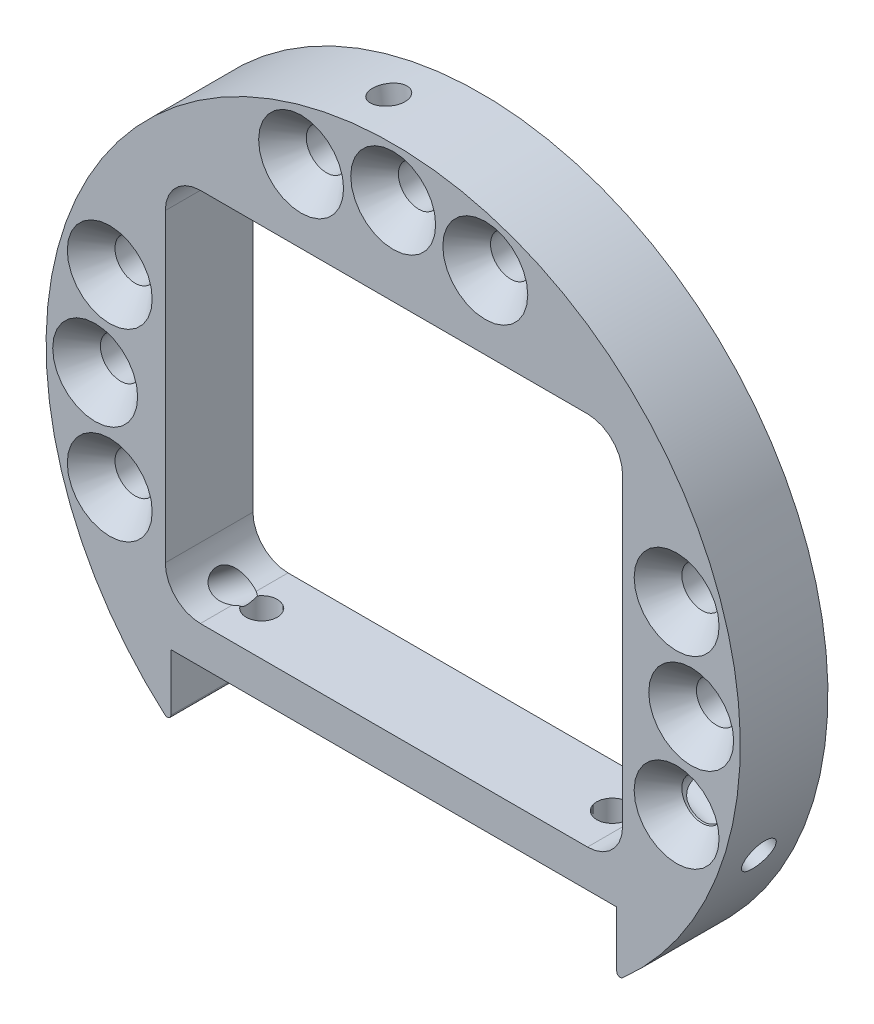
SolidWorks part; units mm, degrees
ref_plane "Front Plane" through (0, 0, 0) normal (0, 0, 1) x (1, 0, 0)
ref_plane "Top Plane" through (0, 0, 0) normal (0, 1, 0) x (1, 0, 0)
ref_plane "Right Plane" through (0, 0, 0) normal (1, 0, 0) x (0, 0, -1)
sketch "Sketch1" plane through (0, 0, 0) normal (0, 0, 1) x (1, 0, 0)
  line L0 (0, 0) -> (-25.146, 0) construction
  line L1 (0, 0) -> (12.573, 21.7771) construction
  line L2 (0, 0) -> (12.573, -21.7771) construction
  circle A0 centre (0, 0) radius 25.146
  dimension "D1" = 50.292
  dimension "D2" = 120
  dimension "D3" = 120
extrude "Boss-Extrude1" add sketch "Sketch1" along normal blind 6.35
sketch "Sketch2" plane through (0, 0, 6.35) normal (0, 0, 1) x (1, 0, 0)
  line L1 (-24.9185, -14.6395) -> (24.0391, -14.6395)
  line L2 (-24.9185, -14.6395) -> (-24.9185, -26.8241)
  line L3 (-24.9185, -26.8241) -> (24.0391, -26.8241)
  line L4 (24.0391, -14.6395) -> (24.0391, -26.8241)
extrude "Cut-Extrude1" cut sketch "Sketch2" against normal blind 4.7625
sketch "Sketch3" plane through (0, 0, 6.35) normal (0, 0, 1) x (1, 0, 0)
  line L1 (29.7951, -26.5733) -> (19.05, -26.5733)
  line L2 (29.7951, -26.5733) -> (29.7951, 23.8125)
  line L3 (29.7951, 23.8125) -> (19.05, 23.8125)
  line L4 (19.05, -26.5733) -> (19.05, 23.8125)
  dimension "D1" = 19.05
extrude "Cut-Extrude3" cut sketch "Sketch3" against normal blind 4.7625
sketch "Sketch5" plane through (0, 0, 6.35) normal (0, 0, 1) x (1, 0, 0)
  line L0 (16.1942, -14.6395) -> (16.1942, -19.2372)
  line L1 (19.05, -14.6395) -> (-20.4452, -14.6395) construction
  line L2 (19.05, -14.6395) -> (20.4452, -14.6395)
  line L3 (16.1942, -14.6395) -> (19.05, -14.6395)
  line L4 (-16.1067, -14.6395) -> (-16.1067, -19.3105)
  line L5 (-20.4452, -14.6395) -> (-16.1067, -14.6395)
  circle A0 centre (0, 0) radius 25.146 construction
  arc A1 (16.1942, -19.2372) -> (20.4452, -14.6395) centre (0, 0) ccw
  arc A2 (-16.1067, -19.3105) -> (-20.4452, -14.6395) centre (0, 0) cw
extrude "Boss-Extrude2" add sketch "Sketch5" against normal blind 4.7625
hole_wizard "#4-40 Tapped Hole1" positions "Sketch6" profile "Sketch7" tap size "#4-40" standard "ANSI Inch"
sketch "Sketch6" plane through (0, -14.6395, 0) normal (0, -1, 0) x (-1, 0, 0)
  line L0 (-16.1942, 0) -> (16.1067, 0) construction
  point P0 (12.7, -3.175)
  point P2 (-12.7, -3.175)
  dimension "D1" = 25.4
  dimension "D2" = 12.7
  dimension "D3" = 3.175
sketch "Sketch7" plane through (-12.7, -14.6395, 3.175) normal (1, 0, 0) x (0, 0, -1)
  line L0 (0, 0) -> (0, 6.7752)
  line L1 (0, 6.7752) -> (1.1303, 6.096)
  line L2 (1.1303, 6.096) -> (1.1303, 0)
  line L5 (1.1303, 0) -> (0, 0)
  line L10 (0, 6.7752) -> (-1.1303, 6.096) construction
  line L11 (0, -6.35) -> (0, 107.95) construction
  dimension "Tap Drill Dia." = 2.2606
  dimension "Tap Drill Depth" = 6.096
  dimension "Drill Angle" = 118
sketch "Sketch8" plane through (0, 0, 6.35) normal (0, 0, 1) x (1, 0, 0)
  line L0 (16.6168, 11.9363) -> (16.6168, 15.4391)
  line L3 (-19.2876, -11.9363) -> (16.6168, -11.9363)
  line L4 (16.6168, 11.9363) -> (16.6168, -11.9363)
  circle A0 centre (0, 0) radius 22.6823 construction
  arc A2 (16.6168, 15.4391) -> (-19.2876, -11.9363) centre (0, 0) ccw
  point P0 (0, 0)
extrude "Cut-Extrude4" cut sketch "Sketch8" against normal blind 6.35
sketch "Sketch9" plane through (0, 0, 6.35) normal (0, 0, 1) x (1, 0, 0)
  line L0 (-14.0723, 17.7892) -> (14.0723, 17.7892)
  circle A0 centre (0, 0) radius 22.6823 construction
  arc A1 (14.0723, 17.7892) -> (-14.0723, 17.7892) centre (0, 0) ccw
extrude "Boss-Extrude3" add sketch "Sketch9" against normal blind 6.35 separate body
combine bodies "Combine1" operation type add bodies to combine 106 107
sketch "Sketch12" plane through (0, 0, 6.35) normal (0, 0, 1) x (1, 0, 0)
  line L0 (19.05, 16.414) -> (19.05, -14.6395) construction
  line L1 (19.05, 16.414) -> (18.1261, 16.414)
  line L2 (18.1261, 16.414) -> (18.1261, -15.0455)
  line L3 (18.1261, -15.0455) -> (20.1483, -15.0455)
  arc A0 (19.05, 16.414) -> (20.1483, -15.0455) centre (0, 0) cw
extrude "Boss-Extrude4" add sketch "Sketch12" against normal up to surface (6.35 mm away)
mirror "Mirror1" about plane through (0, 0, 0) normal (1, 0, 0) of "Boss-Extrude4"
sketch "Sketch13" plane through (0, 0, 6.35) normal (0, 0, 1) x (1, 0, 0)
  line L0 (-16.51, 16.3128) -> (-16.51, -12.6861)
  line L2 (-16.51, -12.6861) -> (-19.239, -12.6541)
  line L3 (-19.239, -12.6541) -> (-19.239, 13.8267)
  line L4 (-19.239, 13.8267) -> (-16.51, 16.3128)
  dimension "D1" = 16.51
extrude "Boss-Extrude7" add sketch "Sketch13" against normal up to surface (6.35 mm away) contours L3 L4 L0 L2
ref_plane "Plane1" through (16.6168, -11.9363, 6.35) normal (1, 0, 0) x (0, 0, -1)
sketch "Sketch14" plane through (0, 0, 6.35) normal (0, 0, 1) x (1, 0, 0)
  line L0 (-17.8389, 15.24) -> (17.6266, 15.24)
  line L1 (17.6266, 15.24) -> (15.248, 17.2787)
  line L2 (15.248, 17.2787) -> (13.7912, 18.6451)
  line L3 (13.7912, 18.6451) -> (-12.9382, 18.6451)
  line L4 (-12.9382, 18.6451) -> (-16.0975, 17.0228)
  line L5 (-16.0975, 17.0228) -> (-17.8389, 15.24)
  dimension "D1" = 15.24
extrude "Boss-Extrude8" add sketch "Sketch14" against normal up to surface (6.35 mm away)
sketch "Sketch16" plane through (0, 0, 6.35) normal (0, 0, 1) x (1, 0, 0)
  line L1 (-16.51, 20.7015) -> (16.51, 20.7015)
  line L2 (-16.51, 20.7015) -> (-16.51, -12.3185)
  line L3 (-16.51, -12.3185) -> (16.51, -12.3185)
  line L4 (16.51, 20.7015) -> (16.51, -12.3185)
  line L5 (-16.51, 20.7015) -> (16.51, -12.3185) construction
  line L6 (-16.51, -12.3185) -> (16.51, 20.7015) construction
  point P0 (0, 4.1915)
  dimension "D1" = 33.02
  dimension "D2" = 33.02
hole_wizard "CSK for #4 Flat Head Machine Screw (100)1" positions "Sketch10" profile "Sketch11" countersink size "#4" standard "ANSI Inch"
sketch "Sketch10" plane through (0, 0, 6.35) normal (0, 0, 1) x (1, 0, 0)
  point P0 (0, 21.59)
  dimension "D1" = 21.59
sketch "Sketch11" plane through (0, 21.59, 6.35) normal (1, 0, 0) x (0, -1, 0)
  line L0 (0, 0) -> (0, 26.2852)
  line L1 (0, 26.2852) -> (1.4732, 25.4)
  line L2 (1.4732, 25.4) -> (1.4732, 1.8465)
  line L3 (1.4732, 1.8465) -> (3.0783, 0)
  line L5 (3.0783, 0) -> (0, 0)
  line L6 (-1.4732, 1.8465) -> (-3.0783, 0) construction
  line L10 (0, 26.2852) -> (-1.4732, 25.4) construction
  line L11 (0, -6.35) -> (0, 107.95) construction
  dimension "Hole Dia." = 2.9464
  dimension "Hole Depth" = 25.4
  dimension "Near C'Sink Dia." = 6.1566
  dimension "Near C'Sink Angle" = 82
  dimension "Drill Angle" = 118
pattern_circular "CirPattern1" count 4 over 360 about axis through (0, 0, 0) along (0, 0, 1) of "CSK for #4 Flat Head Machine Screw (100)1"
pattern_circular "CirPattern2" count 2 every 18 about axis through (0, 0, 0) along (0, 0, 1) of "CirPattern1", "CSK for #4 Flat Head Machine Screw (100)1"
pattern_circular "CirPattern3" count 2 every 18 about axis through (0, 0, 0) along (0, 0, 1) of "CirPattern1", "CSK for #4 Flat Head Machine Screw (100)1"
fillet "Fillet7" radius 2.54 4 edges at (-16.51, -11.9363, 3.175) (16.6168, -11.9363, 3.175) (16.6168, 15.24, 3.175) (-16.51, 15.24, 3.175)
sketch "Sketch18" plane through (0, 0, 1.5875) normal (0, 0, 1) x (1, 0, 0)
  line L1 (-16.1067, -14.6395) -> (16.1942, -14.6395)
  line L2 (-16.1067, -14.6395) -> (-16.1067, -26.8579)
  line L3 (-16.1067, -26.8579) -> (16.1942, -26.8579)
  line L4 (16.1942, -14.6395) -> (16.1942, -26.8579)
extrude "Cut-Extrude5" cut sketch "Sketch18" against normal through all
fillet "Fillet2" radius 0.254 2 edges at (16.1942, -19.2372, 3.175) (-16.1067, -19.3105, 3.175)
ref_plane "Plane3" through (0, 0, 3.175) normal (0, 0, 1) x (1, 0, 0)
sketch "Sketch21" plane through (0, 0, 3.175) normal (0, 0, 1) x (1, 0, 0)
  line L0 (0, 0) -> (-3.9715, 28.2587)
  line L1 (0, 0) -> (0, 30.0835) construction
  dimension "D1" = 8
ref_plane "Plane2" through (-3.9715, 28.2587, 3.175) normal (-0.1392, 0.9903, 0) x (0.9903, 0.1392, 0)
hole_wizard "#4-48 Tapped Hole1" positions "Sketch19" profile "Sketch20" tap size "#4-48" standard "ANSI Inch"
sketch "Sketch19" plane through (-3.9715, 28.2587, 3.175) normal (-0.1392, 0.9903, 0) x (0.9903, 0.1392, 0)
  point P0 (0, 0)
  dimension "D1" = 3.175
sketch "Sketch20" plane through (-3.9715, 28.2587, 3.175) normal (0, 0, 1) x (-0.9903, -0.1392, 0)
  line L0 (0, 0) -> (0, 19.7635)
  line L1 (0, 19.7635) -> (1.1874, 19.05)
  line L2 (1.1874, 19.05) -> (1.1874, 0)
  line L5 (1.1874, 0) -> (0, 0)
  line L10 (0, 19.7635) -> (-1.1875, 19.05) construction
  line L11 (0, -6.35) -> (0, 107.95) construction
  dimension "Tap Drill Dia." = 2.3749
  dimension "Tap Drill Depth" = 19.05
  dimension "Drill Angle" = 118
pattern_circular "CirPattern4" count 3 over 360 about axis through (0, 0, 6.35) along (0, 0, -1) of "#4-48 Tapped Hole1"
